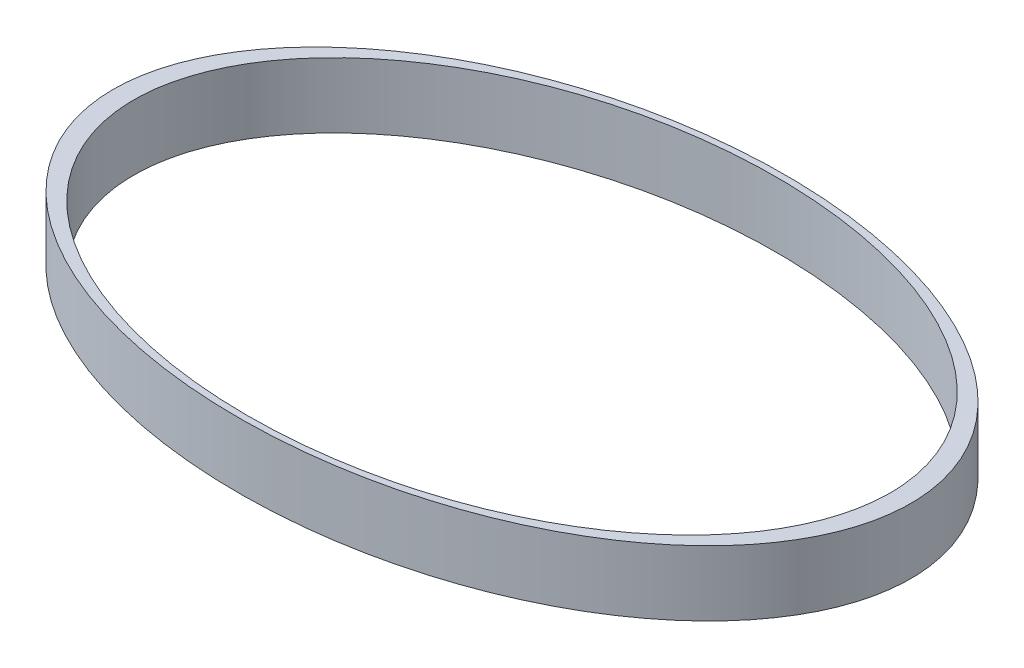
SolidWorks part; units mm, degrees
ref_plane "Front Plane" through (0, 0, 0) normal (0, 0, 1) x (1, 0, 0)
ref_plane "Top Plane" through (0, 0, 0) normal (0, 1, 0) x (1, 0, 0)
ref_plane "Right Plane" through (0, 0, 0) normal (1, 0, 0) x (0, 0, -1)
sketch "Sketch1" plane through (0, 0, 0) normal (0, 1, 0) x (1, 0, 0)
  ellipse E0 centre (181.5033, -2.1389) end of major axis (123.5142, -7.3251) minor radius 36.871
  ellipse E1 centre (181.5033, -2.1389) end of major axis (236.5128, 2.912) minor radius 35.9209
  point P0 (184.7877, -38.8634)
  point P2 (0, 0)
  point P18 (0, 0)
extrude "Boss-Extrude1" add sketch "Sketch1" along normal blind 10
